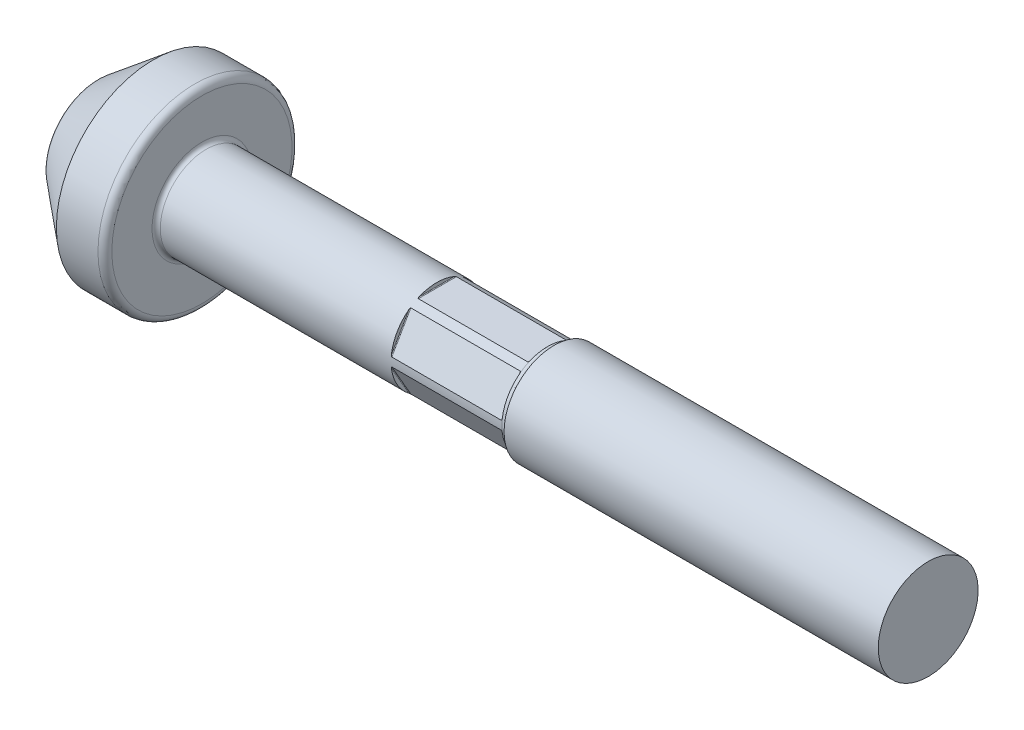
SolidWorks part; units mm, degrees
ref_plane "Face" through (0, 0, 0) normal (0, 0, 1) x (1, 0, 0)
ref_plane "Dessus" through (0, 0, 0) normal (0, 1, 0) x (1, 0, 0)
ref_plane "Droite" through (0, 0, 0) normal (1, 0, 0) x (0, 0, -1)
sketch "Esquisse1" plane through (0, 0, 0) normal (0, 0, 1) x (1, 0, 0)
  line L0 (0, 0) -> (600, 0)
  line L1 (0, 0) -> (0, 34.414)
  line L2 (1.8534, 38.2997) -> (41, 70)
  line L3 (41, 70) -> (71, 70)
  line L4 (76, 65) -> (76, 33)
  line L5 (76, 33) -> (251, 33)
  line L9 (251, 33) -> (325.4174, 33)
  line L11 (330, 36) -> (600, 36)
  line L12 (600, 36) -> (600, 0)
  arc A1 (71, 70) -> (76, 65) centre (71, 65) cw
  arc A2 (0, 34.414) -> (1.8534, 38.2997) centre (5, 34.414) cw
  arc A3 (325.4174, 33) -> (330, 36) centre (325.4174, 38) ccw
  dimension "D6" = 5
  dimension "D1" = 600
  dimension "D2" = 33
  dimension "D3" = 36
  dimension "D4" = 70
  dimension "D5" = 39
  dimension "D7" = 270
  dimension "D8" = 79
  dimension "D9" = 35
  dimension "D10" = 41
revolve "Révolution1" add sketch "Esquisse1" angle 360 about L0
sketch "Esquisse2" plane through (0, 0, 0) normal (0, 0, 1) x (1, 0, 0)
  line L0 (0, 0) -> (618.0804, 0) construction
  line L1 (325.4174, 33) -> (325.4174, -33) construction
  line L2 (245.4174, 30) -> (325.4174, 30)
  line L3 (245.4174, 30) -> (245.4174, 50)
  line L4 (245.4174, 50) -> (325.4174, 50)
  line L5 (325.4174, 30) -> (325.4174, 50)
  dimension "D1" = 60
  dimension "D2" = 80
  dimension "D3" = 20
extrude "Enlèv. mat.-Extru.1" cut sketch "Esquisse2" against normal through all both and the other way through all
fillet "Congé1" radius 0.5 2 edges at (325.4174, 30, 0) (245.4174, 30, 0)
fillet "Congé2" [suppressed] radius 0.5
pattern_circular "Répétition circulaire2" count 6 over 360 about axis through (0, 0, 0) along (1, 0, 0) of "Enlèv. mat.-Extru.1", "Congé1"
fillet "Congé3" radius 3 1 edges at (76, 0, 33)
